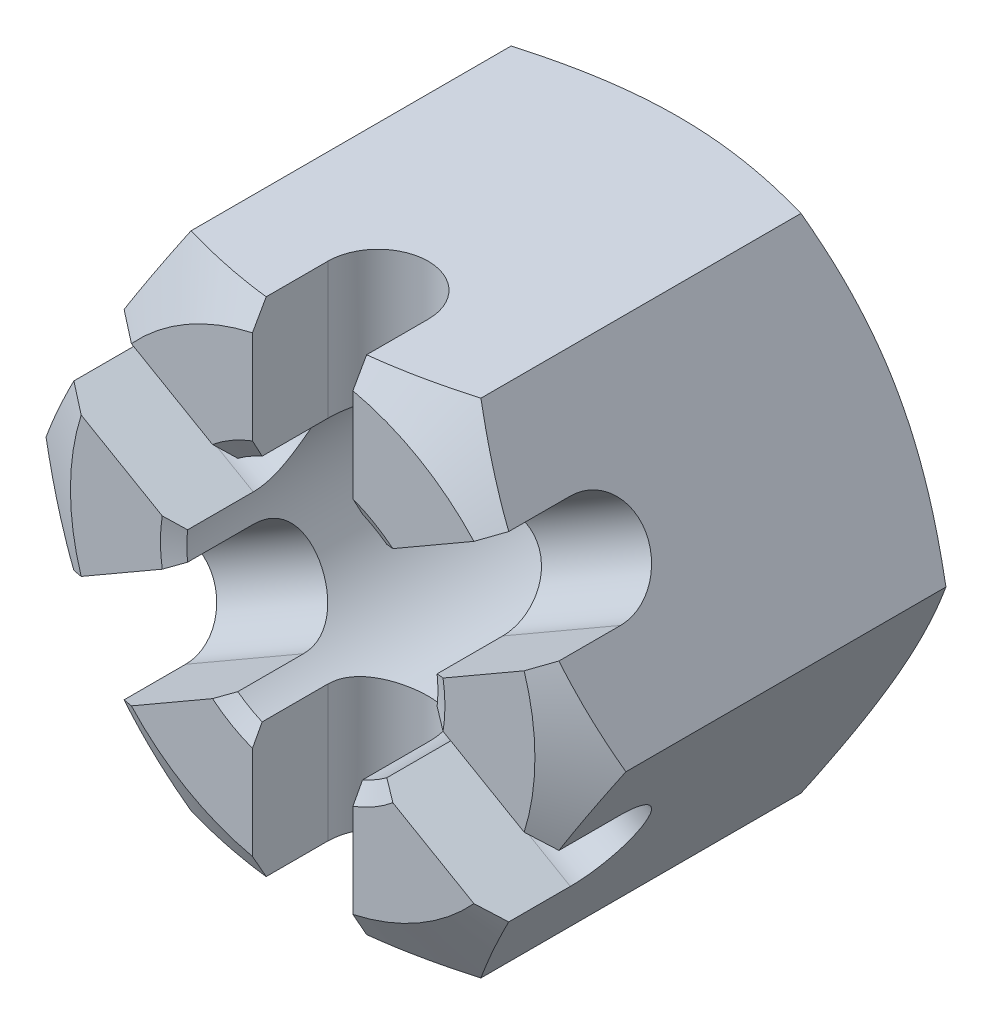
SolidWorks part; units mm, degrees
ref_plane "Front" through (0, 0, 0) normal (0, 0, 1) x (1, 0, 0)
ref_plane "Top" through (0, 0, 0) normal (0, 1, 0) x (1, 0, 0)
ref_plane "Right" through (0, 0, 0) normal (1, 0, 0) x (0, 0, -1)
other "Configuration Table"
sketch "Sketch1" plane through (0, 0, 0) normal (0, 0, 1) x (1, 0, 0)
  line L1 (2.8868, -5) -> (5.7735, 0)
  line L2 (5.7735, 0) -> (2.8868, 5)
  line L3 (2.8868, 5) -> (-2.8868, 5)
  line L4 (-2.8868, 5) -> (-5.7735, 0)
  line L5 (-5.7735, 0) -> (-2.8868, -5)
  line L6 (-2.8868, -5) -> (2.8868, -5)
  circle A0 centre (0, 0) radius 5 construction
  circle A1 centre (0, 0) radius 2.5
extrude "BaseNut" add sketch "Sketch1" against normal blind 7.7
sketch "Sketch2" plane through (0, 0, 0) normal (0, 1, 0) x (1, 0, 0)
  line L0 (-5.7735, 7.7) -> (-4.625, 7.7)
  line L2 (-4.625, 7.7) -> (-5.7735, 7.0369)
  line L3 (-5.7735, 7.0369) -> (-5.7735, 7.7)
  line L4 (0, 3.3759) -> (0, -9.8171) construction
  line L6 (-9.7712, 3.85) -> (9.8853, 3.85) construction
  line L7 (-5.7735, 0.6631) -> (-5.7735, 0)
  line L8 (-4.625, 0) -> (-5.7735, 0.6631)
  line L9 (-5.7735, 0) -> (-4.625, 0)
  line L10 (-5.7735, 7.7) -> (-5.7735, 0) construction
revolve "Double-Chamfer" cut sketch "Sketch2" angle 360 about L4
chamfer "EndChamfer" distance 0.3333 angle 30 2 edges at (2.5, 0, -7.7) (2.5, 0, 0)
sketch "Sketch3" plane through (0, 0, 0) normal (0, 1, 0) x (1, 0, 0)
  line L0 (0, 4.2201) -> (0, -10.5237) construction
  line L2 (-1, 0) -> (-1, 1.5)
  line L3 (1, 0) -> (1, 1.5)
  line L4 (2.6925, 7.7) -> (-2.6925, 7.7) construction
  arc A0 (-1, 1.5) -> (1, 1.5) centre (0, 1.5) cw
  point P2 (0, 2.5)
  point P3 (0, 7.7)
extrude "Slot" cut sketch "Sketch3" against normal through all and the other way through all
ref_axis "Axis1" through (0, 0, 1.7096) along (0, 0, -1)
pattern_circular "SlotPattern" count 3 over 360 about axis through (0, 0, 1.7096) along (0, 0, -1) of "Slot"
sketch "Sketch4" plane through (0, 0, 0) normal (0, 1, 0) x (1, 0, 0)
  line L0 (4.625, 0) -> (4.625, 2.5)
  line L2 (4.625, 2.5) -> (5.7735, 3.1631)
  line L4 (4.625, 0) -> (5.7735, 0)
  line L5 (5.7735, 0) -> (5.7735, 3.1631)
  line L7 (0, -0.375) -> (0, -8.8366) construction
  line L9 (4.4106, 0) -> (4.625, 0) construction
  line L10 (5.7735, 7.0369) -> (5.7735, 0.6631) construction
revolve "Cut-Revolve1" [suppressed] cut sketch "Sketch4" angle 360 about L7
sketch "Sketch5" plane through (0, 0, 0) normal (0, 1, 0) x (1, 0, 0)
  line L0 (0, 9.8217) -> (0, -3.0923) construction
  line L1 (2, 7.6167) -> (2, 7.1167)
  line L2 (2, 7.1167) -> (2.5, 7.1167)
  line L3 (2.5, 7.1167) -> (2.933, 7.3667)
  line L4 (2.933, 7.3667) -> (2.5, 7.6167)
  line L5 (2.5, 7.6167) -> (2, 7.6167)
  line L6 (2.5, 7.3667) -> (-2.5, 7.3667) construction
revolve "Cut-Revolve10" [suppressed] cut sketch "Sketch5" angle 360 about L0
pattern_linear "LPattern10" [suppressed] count 12 spacing 0.6 along (0, 0, 1)
equation "\"dw@Sketch2\" = \"s@Sketch1\"-0.75"
equation "\"de@Sketch4\" = \"dw@Sketch2\""
equation "\"D1@Sketch3\" = \"m@BaseNut\" - \"W@Sketch3\""
equation "\"D2@Sketch2\" = \"m@BaseNut\" / 2"
equation "\"W@Sketch4\" = \"W@Sketch3\""
equation "\"D2@Sketch5\" = \"D1@Sketch1\""
equation "\"D1@Sketch5\" = (  \"D@ThreadCosmetic1\" - \"D1@Sketch1\" )  / 2"
equation "\"D3@LPattern10\" = \"D1@Sketch5\" * 1.2"
equation "\"D1@LPattern10\" = \"m@BaseNut\" / \"D3@LPattern10\" - 1"
equation "\"D1@EndChamfer\" = \"D1@Sketch1\" / 15"
